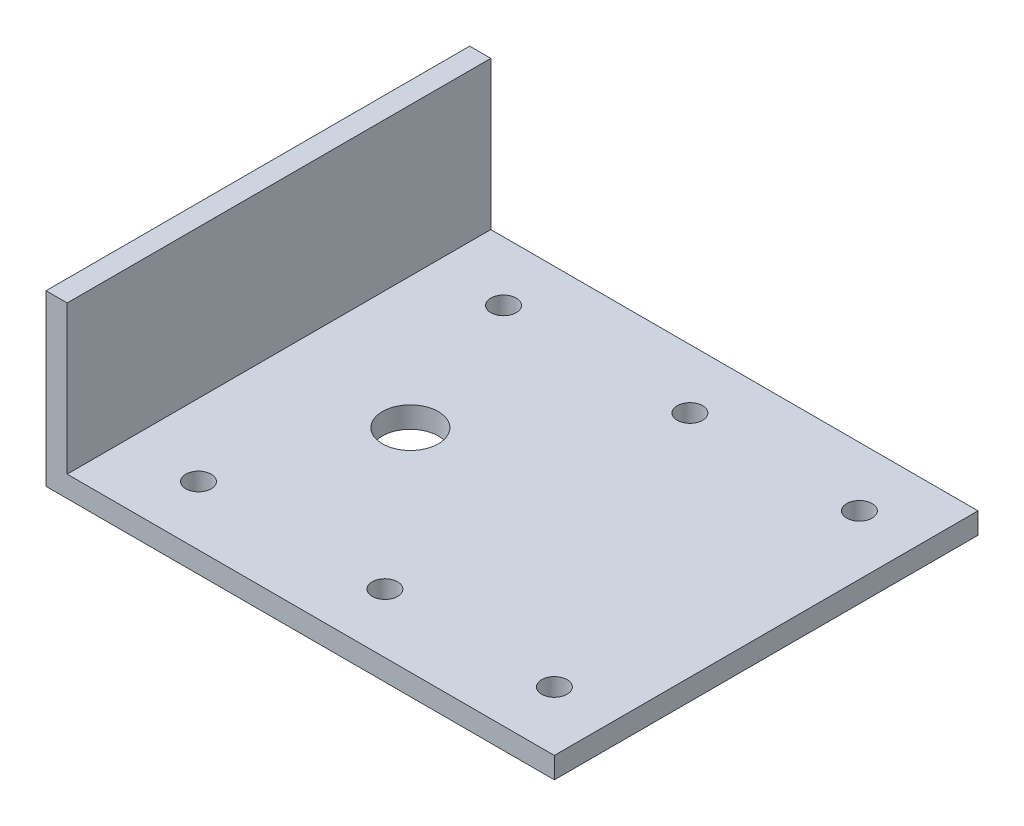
SolidWorks part; units mm, degrees
ref_plane "Face" through (0, 0, 0) normal (0, 0, 1) x (1, 0, 0)
ref_plane "Dessus" through (0, 0, 0) normal (0, 1, 0) x (1, 0, 0)
ref_plane "Droite" through (0, 0, 0) normal (1, 0, 0) x (0, 0, -1)
sketch "Esquisse1" plane through (0, 0, 0) normal (0, 0, 1) x (1, 0, 0)
  line L0 (0, 0) -> (60, 0)
  line L1 (0, 0) -> (0, 20)
  dimension "D1" = 60
  dimension "D2" = 20
extrude "Extru.-Mince1" add sketch "Esquisse1" along normal mid plane 50 thin
hole_wizard "Dégagement M61" positions "Esquisse3" profile "Esquisse2" hole size "M6" standard "ISO"
sketch "Esquisse3" plane through (0, 0, 0) normal (0, -1, 0) x (1, 0, 0)
  point P0 (18, 0)
  dimension "D1" = 18
sketch "Esquisse2" plane through (18, 0, 0) normal (1, 0, 0) x (0, 0, -1)
  line L0 (0, 0) -> (0, 20)
  line L1 (0, 20) -> (3.3, 20)
  line L2 (3.3, 20) -> (3.3, 0)
  line L5 (3.3, 0) -> (0, 0)
  line L11 (0, -6.35) -> (0, 107.95) construction
  dimension "Diamètre du perçage jusqu'au prochain" = 6.6
  dimension "Profondeur du perçage jusqu'au prochain" = 20
sketch "Esquisse6" plane through (0, 0, 0) normal (0, -1, 0) x (1, 0, 0)
  line L0 (0, 0) -> (70.8005, 0) construction
  line L1 (60, 25) -> (60, -25) construction
  circle A0 centre (53, 18) radius 1.5
  circle A1 centre (53, -18) radius 1.5
  circle A2 centre (33, 18) radius 1.5
  circle A3 centre (33, -18) radius 1.5
  circle A4 centre (11, 18) radius 1.5
  circle A5 centre (11, -18) radius 1.5
  dimension "D5" = 3
  dimension "D1" = 36
  dimension "D2" = 22
  dimension "D3" = 20
  dimension "D4" = 7
extrude "Extrusion1" cut sketch "Esquisse6" against normal up to next
